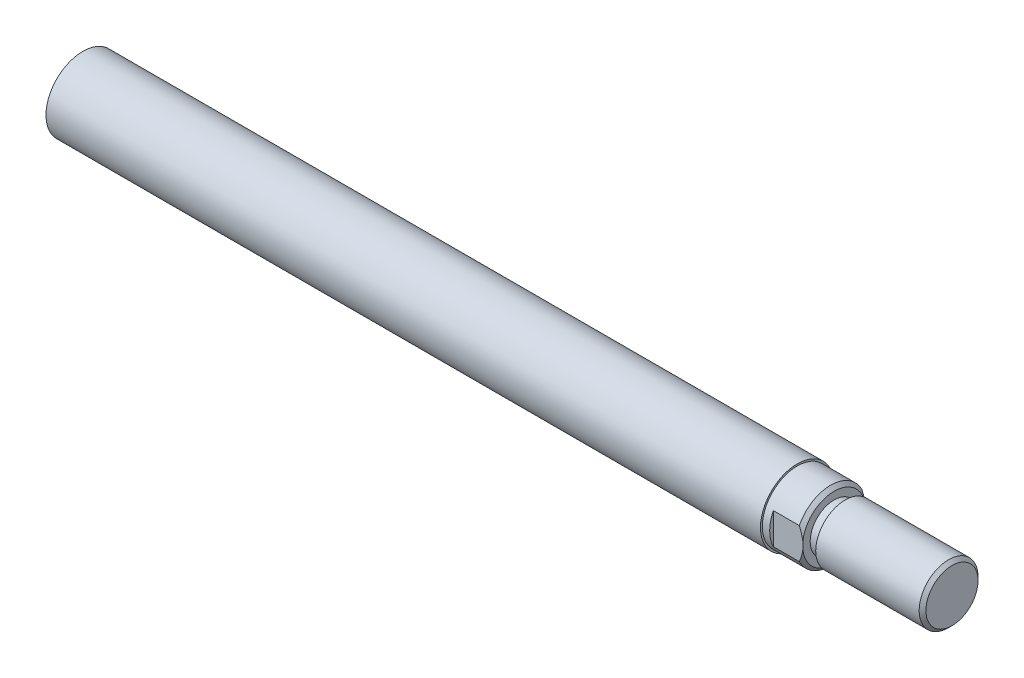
SolidWorks part; units mm, degrees
ref_plane "Plano frontal" through (0, 0, 0) normal (0, 0, 1) x (1, 0, 0)
ref_plane "Plano superior" through (0, 0, 0) normal (0, 1, 0) x (1, 0, 0)
ref_plane "Plano direito" through (0, 0, 0) normal (1, 0, 0) x (0, 0, -1)
imported_body "Bruto-CPME50-130-1"
sketch "Esboço1" plane through (-187, 0, 0) normal (1, 0, 0) x (0, 0, -1)
  circle A1 centre (0, 0) radius 25
  circle A2 centre (0, 0) radius 25
  dimension "D1" = 0
extrude "Corte-extrusão1" cut sketch "Esboço1" against normal through all
hole_wizard "Furo roscado de M10x1.51" positions "Esboço3" profile "Esboço4" tap size "M10x1.5" standard "Ansi Metric"
sketch "Esboço3" plane through (-187, 0, 0) normal (-1, 0, 0) x (0, 0, 1)
  point P0 (0, 0)
sketch "Esboço4" plane through (-187, 0, 0) normal (0, 1, 0) x (0, 0, 1)
  line L0 (0, 0) -> (0, 22.5537)
  line L1 (0, 22.5537) -> (4.25, 20)
  line L2 (4.25, 20) -> (4.25, 0)
  line L5 (4.25, 0) -> (0, 0)
  line L10 (0, 22.5537) -> (-4.25, 20) construction
  line L11 (0, -6.35) -> (0, 107.95) construction
  dimension "Tap Drill Dia." = 8.5
  dimension "Tap Drill Depth" = 20
  dimension "Drill Angle" = 118
